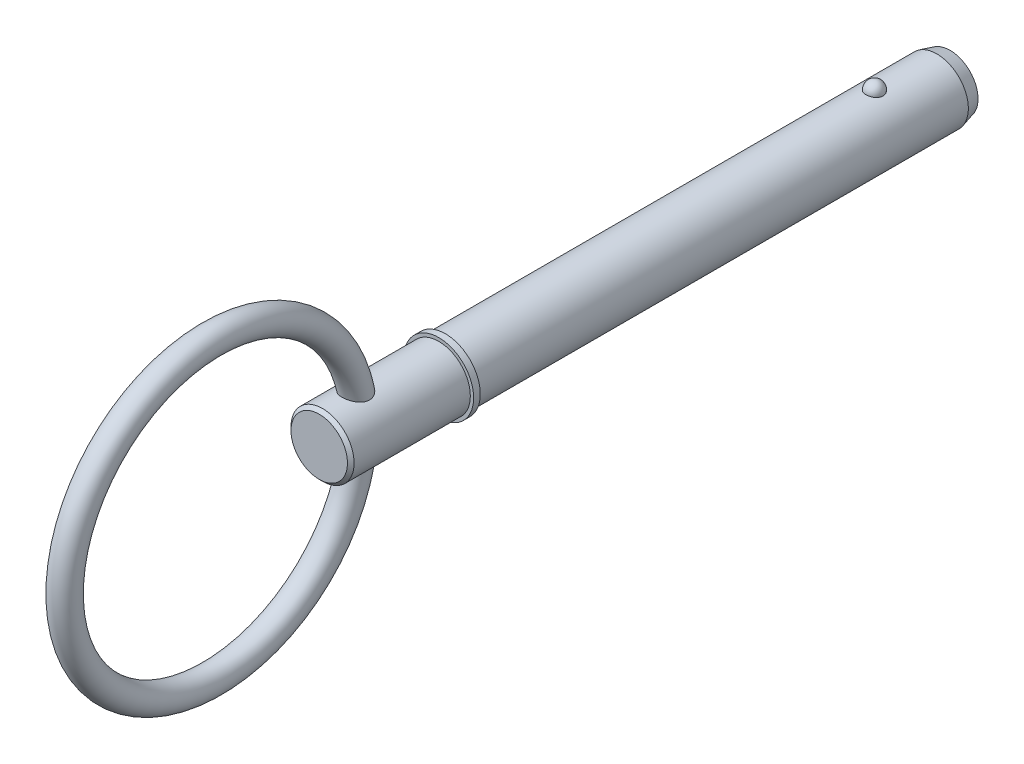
SolidWorks part; units mm, degrees
ref_plane "Front Plane" through (0, 0, 0) normal (0, 0, 1) x (1, 0, 0)
ref_plane "Top Plane" through (0, 0, 0) normal (0, 1, 0) x (1, 0, 0)
ref_plane "Right Plane" through (0, 0, 0) normal (1, 0, 0) x (0, 0, -1)
sketch "Sketch2" plane through (0, 0, 0) normal (0, 0, 1) x (1, 0, 0)
  circle A0 centre (0, 0) radius 4.765
  point P3 (0, 4.765)
  dimension "D1" = 9.53
extrude "Boss-Extrude1" add sketch "Sketch2" along normal blind 63.5
sketch "Sketch3" plane through (0, 0, 0) normal (0, 0, -1) x (-1, 0, 0)
  circle A0 centre (0, 0) radius 4.765
  dimension "D1" = 9.53
extrude "Boss-Extrude2" add sketch "Sketch3" along normal blind 12.7
chamfer "Chamfer1" distance 2 angle 15 1 edges at (-4.765, 0, -12.7)
sketch "Sketch18" plane through (0, 0, 0) normal (1, 0, 0) x (0, 0, -1)
  line L0 (10.7, 4.765) -> (-63.5, 4.765) construction
  line L1 (1.29, 6.055) -> (1.29, 3.475)
  line L2 (-63.5, -4.765) -> (10.7, -4.765) construction
  arc A0 (1.29, 6.055) -> (1.29, 3.475) centre (1.29, 4.765) ccw
  point P4 (0, 4.765)
  dimension "D1" = 10.82
revolve "Revolve1" add sketch "Sketch18" angle 360 about L1
sketch "Sketch19" plane through (0, 0, 0) normal (1, 0, 0) x (0, 0, -1)
  line L0 (-33.7288, 0) -> (-46.4542, 0) construction
sketch "Sketch20" plane through (0, 0, 0) normal (1, 0, 0) x (0, 0, -1)
  line L0 (-63.5, 0) -> (-63.5, 5.265)
  line L1 (-63.5, 4.765) -> (-63.5, -4.765) construction
  line L2 (-63.5, 5.265) -> (-64.5, 5.265)
  line L3 (-64.5, 5.265) -> (-64.5, 0)
  line L4 (-33.7288, 0) -> (-46.4542, 0) construction
  line L5 (-64.5, 0) -> (-63.5, 0)
  dimension "D1" = 5.265
  dimension "D2" = 1
revolve "Revolve2" add sketch "Sketch20" angle 360 about L0
sketch "Sketch21" plane through (0, 0, 63.5) normal (0, 0, -1) x (-1, 0, 0)
  circle A0 centre (0, 0) radius 4.765
  dimension "D1" = 9.53
extrude "Boss-Extrude3" add sketch "Sketch21" against normal blind 19.05
chamfer "Chamfer2" distance 0.5 angle 45 1 edges at (-4.765, 0, 82.55)
sketch "Sketch23" plane through (0, 0, 0) normal (1, 0, 0) x (0, 0, -1)
  line L0 (-82.55, 4.265) -> (-82.55, -4.265) construction
  circle A0 centre (-98.775, 0) radius 22.225
  point P2 (-76.55, 0)
  dimension "D1" = 44.45
  dimension "D2" = 6
sketch "Sketch24" plane through (0, 0, 0) normal (0, 1, 0) x (1, 0, 0)
  circle A0 centre (0, -76.55) radius 2
  dimension "D1" = 4
sweep "Sweep1" add profiles "Sketch24" path "Sketch23"
